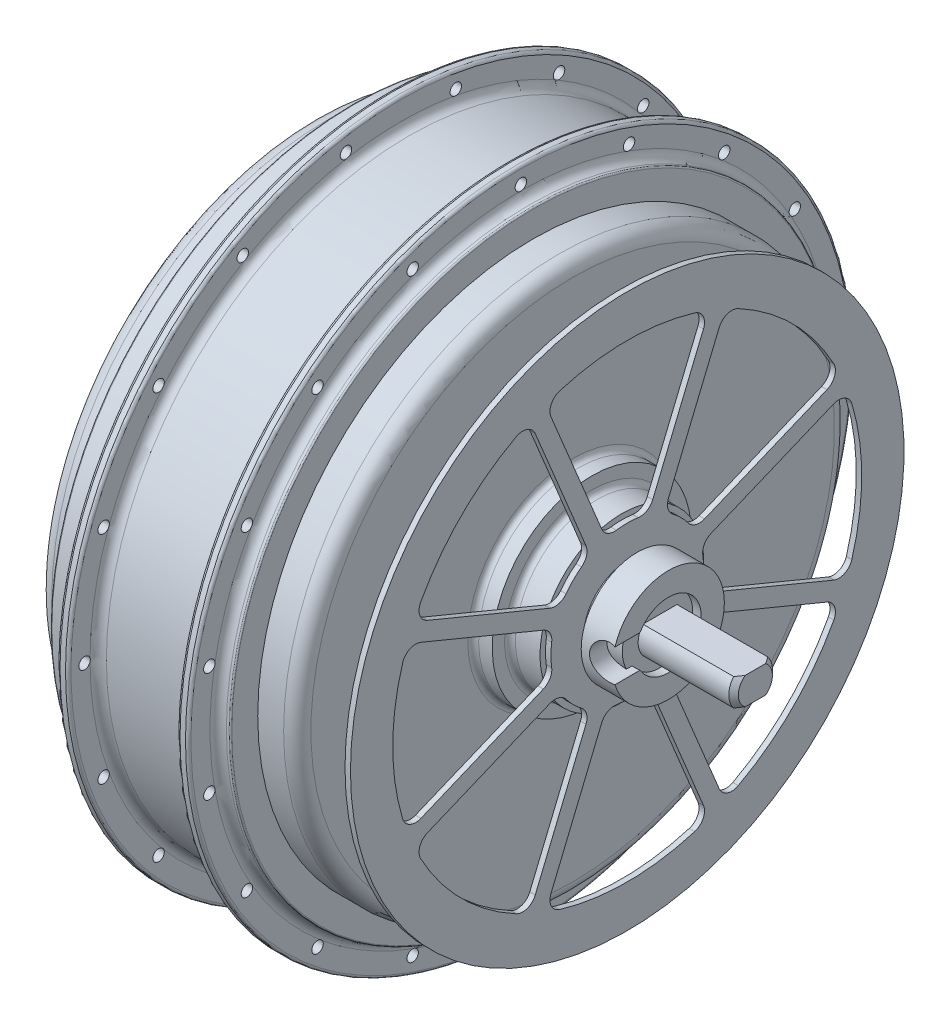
SolidWorks part; units mm, degrees
ref_plane "Front Plane" through (0, 0, 0) normal (0, 0, 1) x (1, 0, 0)
ref_plane "Top Plane" through (0, 0, 0) normal (0, 1, 0) x (1, 0, 0)
ref_plane "Right Plane" through (0, 0, 0) normal (1, 0, 0) x (0, 0, -1)
sketch "Sketch1" plane through (0, 0, 0) normal (0, 0, 1) x (1, 0, 0)
  line L0 (0, 0) -> (110, 0) construction
  line L1 (0, 0) -> (-110, 0) construction
  line L2 (0, 0) -> (0, 66.545) construction
  line L3 (-20, 111) -> (20, 111)
  line L4 (20, 111) -> (20, 122)
  line L5 (20, 122) -> (24, 122)
  line L6 (24, 122) -> (24, 111)
  line L7 (-20, 111) -> (-20, 122)
  line L8 (-20, 122) -> (-24, 122)
  line L9 (-24, 122) -> (-24, 111)
  line L10 (-24, 111) -> (-37.5, 111)
  line L11 (-37.5, 111) -> (-37.5, 101)
  line L12 (-37.5, 101) -> (-52, 101)
  line L13 (-52, 101) -> (-52, 26.5)
  line L14 (-52, 26.5) -> (-57.5, 26.5)
  line L15 (-57.5, 26.5) -> (-57.5, 17.45)
  line L16 (-57.5, 17.45) -> (-71.5, 17.45)
  line L17 (-71.5, 17.45) -> (-71.5, 0)
  line L18 (24, 111) -> (28.5, 111)
  line L19 (28.5, 111) -> (28.5, 101)
  line L20 (28.5, 101) -> (43, 101)
  line L21 (43, 101) -> (43, 36.5)
  line L22 (43, 36.5) -> (50, 36.5)
  line L23 (50, 36.5) -> (50, 30)
  line L24 (50, 30) -> (61, 30)
  line L25 (61, 30) -> (61, 0)
  line L26 (-71.5, 10) -> (-75, 10)
  line L27 (-75, 10) -> (-75, 0)
  line L28 (61, 14.4602) -> (75, 13.8)
  line L29 (75, 13.8) -> (75, 0)
  line L30 (61, 30) -> (61, 101.5)
  line L31 (61, 101.5) -> (63, 101.5)
  line L32 (63, 101.5) -> (63, 0)
  line L33 (-58, 17.45) -> (-58, 27.25)
  line L34 (-58, 27.25) -> (-74, 27.25)
  line L35 (-74, 27.25) -> (-74, 17.45)
  line L36 (-74, 17.45) -> (-71.5, 17.45)
  line L37 (-64.9, 27.25) -> (-64.9, 35.25)
  line L38 (-64.9, 35.25) -> (-67.1, 35.25)
  line L39 (-67.1, 35.25) -> (-67.1, 27.25)
  line L40 (-66, 35.25) -> (-66, 27.25) construction
  line L41 (-75, 8) -> (-110, 8)
  line L42 (-110, 8) -> (-110, 0)
  line L43 (75, 8) -> (110, 8)
  line L44 (110, 8) -> (110, 0)
  line L45 (-71.5, 10) -> (61, 10)
  line L46 (61, 16) -> (63, 16)
  line L47 (75, 12) -> (78.12, 12)
  line L48 (78.12, 12) -> (78.12, 20.5)
  line L49 (78.12, 20.5) -> (66.62, 20.5)
  line L50 (66.62, 20.5) -> (66.62, 14.1952)
  line L51 (-75, 10) -> (-75, 15)
  line L52 (-75, 15) -> (-77.88, 15)
  line L53 (-77.88, 15) -> (-77.88, 8)
  dimension "D1" = 244
  dimension "D2" = 222
  dimension "D3" = 4
  dimension "D4" = 34.9
  dimension "D5" = 13.5
  dimension "D6" = 4.5
  dimension "D7" = 14.5
  dimension "D8" = 14.5
  dimension "D9" = 202
  dimension "D10" = 48
  dimension "D11" = 95
  dimension "D12" = 53
  dimension "D13" = 20
  dimension "D14" = 75
  dimension "D15" = 71.5
  dimension "D16" = 57.5
  dimension "D17" = 75
  dimension "D18" = 14
  dimension "D19" = 60
  dimension "D20" = 73
  dimension "D21" = 18
  dimension "D22" = 7
  dimension "D23" = 27.6
  dimension "D24" = 2.7
  dimension "D25" = 150
  dimension "D26" = 2
  dimension "D27" = 203
  dimension "D28" = 54.5
  dimension "D29" = 0.5
  dimension "D30" = 16
  dimension "D31" = 2.2
  dimension "D32" = 9
  dimension "D33" = 8
  dimension "D34" = 12
  dimension "D35" = 51
  dimension "D36" = 16
  dimension "D37" = 35
  dimension "D38" = 35
  dimension "D39" = 16
  dimension "D40" = 24
  dimension "D41" = 11.5
  dimension "D42" = 3.12
  dimension "D43" = 41
  dimension "D44" = 30
  dimension "D45" = 2.88
  dimension "D46" = 156
sketch "Sketch2" plane through (0, 0, 0) normal (0, 0, 1) x (1, 0, 0)
  line L0 (-71.5, 17.45) -> (-71.5, 0) construction
  line L1 (-57.5, 17.45) -> (-71.5, 17.45) construction
  line L2 (-57.5, 26.5) -> (-57.5, 17.45) construction
  line L3 (-52, 26.5) -> (-57.5, 26.5) construction
  line L4 (-52, 101) -> (-52, 26.5) construction
  line L5 (-37.5, 101) -> (-52, 101) construction
  line L6 (-37.5, 111) -> (-37.5, 101) construction
  line L7 (-24, 111) -> (-37.5, 111) construction
  line L8 (-24, 122) -> (-24, 111) construction
  line L9 (-20, 122) -> (-24, 122) construction
  line L10 (-20, 111) -> (-20, 122) construction
  line L11 (-20, 111) -> (20, 111) construction
  line L12 (20, 111) -> (20, 122) construction
  line L13 (20, 122) -> (24, 122) construction
  line L14 (24, 122) -> (24, 111) construction
  line L15 (24, 111) -> (28.5, 111) construction
  line L16 (28.5, 111) -> (28.5, 101) construction
  line L17 (28.5, 101) -> (43, 101) construction
  line L18 (43, 101) -> (43, 36.5) construction
  line L19 (43, 36.5) -> (50, 36.5) construction
  line L20 (50, 36.5) -> (50, 30) construction
  line L21 (50, 30) -> (61, 30) construction
  line L22 (61, 30) -> (61, 0) construction
  line L23 (0, 0) -> (-110, 0) construction
  line L24 (-71.5, 17.45) -> (-71.5, 0)
  line L25 (-57.5, 17.45) -> (-71.5, 17.45)
  line L26 (-57.5, 26.5) -> (-57.5, 17.45)
  line L27 (-52, 26.5) -> (-57.5, 26.5)
  line L28 (-52, 101) -> (-52, 26.5)
  line L29 (-37.5, 101) -> (-52, 101)
  line L30 (-37.5, 111) -> (-37.5, 101)
  line L31 (-24, 111) -> (-37.5, 111)
  line L32 (-24, 122) -> (-24, 111)
  line L33 (-20, 122) -> (-24, 122)
  line L34 (-20, 111) -> (-20, 122)
  line L35 (-20, 111) -> (20, 111)
  line L36 (20, 111) -> (20, 122)
  line L37 (20, 122) -> (24, 122)
  line L38 (24, 122) -> (24, 111)
  line L39 (24, 111) -> (28.5, 111)
  line L40 (28.5, 111) -> (28.5, 101)
  line L41 (28.5, 101) -> (43, 101)
  line L42 (43, 101) -> (43, 36.5)
  line L43 (43, 36.5) -> (50, 36.5)
  line L44 (50, 36.5) -> (50, 30)
  line L45 (50, 30) -> (61, 30)
  line L46 (61, 30) -> (61, 0)
  line L47 (0, 0) -> (-71.5, 0)
  line L48 (0, 0) -> (110, 0) construction
  line L49 (0, 0) -> (61, 0)
revolve "Revolve1" add sketch "Sketch2" angle 360 about L1
fillet "Fillet1" radius 5 2 edges at (43, 101, 0) (-52, 101, 0)
fillet "Fillet2" radius 3 4 edges at (-24, 111, 0) (24, 111, 0) (20, 111, 0) (-20, 111, 0)
fillet "Fillet3" radius 1 4 edges at (-24, 122, 0) (20, 122, 0) (24, 122, 0) (-20, 122, 0)
fillet "Fillet4" radius 0.5 2 edges at (-37.5, 111, 0) (28.5, 111, 0)
fillet "Fillet5" radius 2 3 edges at (50, 30, 0) (43, 36.5, 0) (-52, 26.5, 0)
sketch "Sketch3" plane through (0, 0, 0) normal (0, 0, 1) x (1, 0, 0)
  line L0 (0, 0) -> (-110, 0) construction
  line L1 (-110, 8) -> (-110, 0) construction
  line L2 (-75, 8) -> (-110, 8) construction
  line L3 (-75, 10) -> (-75, 0) construction
  line L4 (-71.5, 10) -> (-75, 10) construction
  line L5 (-71.5, 10) -> (61, 10) construction
  line L6 (61, 30) -> (61, 0) construction
  line L7 (61, 14.4602) -> (75, 13.8) construction
  line L8 (75, 13.8) -> (75, 0) construction
  line L9 (75, 8) -> (110, 8) construction
  line L10 (110, 8) -> (110, 0) construction
  line L11 (0, 0) -> (110, 0) construction
  line L12 (0, 0) -> (-110, 0)
  line L13 (-110, 8) -> (-110, 0)
  line L14 (-75, 8) -> (-110, 8)
  line L15 (-75, 10) -> (-75, 8)
  line L16 (-71.5, 10) -> (-75, 10)
  line L17 (-71.5, 10) -> (61, 10)
  line L18 (61, 14.4602) -> (61, 10)
  line L19 (61, 14.4602) -> (75, 13.8)
  line L20 (75, 13.8) -> (75, 8)
  line L21 (75, 8) -> (110, 8)
  line L22 (110, 8) -> (110, 0)
  line L23 (0, 0) -> (110, 0)
revolve "Revolve2" add sketch "Sketch3" angle 360 about L23
sketch "Sketch4" plane through (0, 0, 0) normal (0, 0, 1) x (1, 0, 0)
  line L0 (0, 0) -> (110, 0) construction
  line L1 (63, 101.5) -> (63, 0) construction
  line L2 (61, 30) -> (61, 101.5) construction
  line L3 (61, 101.5) -> (63, 101.5) construction
  line L4 (61, 0) -> (63, 0) construction
  line L5 (63, 101.5) -> (63, 16)
  line L6 (61, 30) -> (61, 101.5)
  line L7 (61, 101.5) -> (63, 101.5)
  line L8 (61, 30) -> (61, 0) construction
  line L9 (61, 30) -> (61, 16)
  line L10 (61, 16) -> (63, 16) construction
  line L11 (61, 16) -> (63, 16)
revolve "Revolve3" add sketch "Sketch4" angle 360 about L4
sketch "Sketch5" plane through (63, 0, 0) normal (1, 0, 0) x (0, 0, -1)
  line L0 (0, 0) -> (0, 88.4744) construction
  line L1 (9.3506, 30.7457) -> (27.9519, 75.6533)
  line L2 (-9.3506, 30.7457) -> (-27.9519, 75.6533)
  arc A0 (24.7728, 82.3548) -> (-24.7728, 82.3548) centre (0, 0) ccw
  arc A1 (4.0143, 27.7107) -> (-4.0143, 27.7107) centre (0, 0) ccw
  arc A2 (9.3506, 30.7457) -> (4.0143, 27.7107) centre (4.7312, 32.6591) cw
  arc A3 (-9.3506, 30.7457) -> (-4.0143, 27.7107) centre (-4.7312, 32.6591) ccw
  arc A4 (27.9519, 75.6533) -> (24.7728, 82.3548) centre (23.3325, 77.5667) ccw
  arc A5 (-27.9519, 75.6533) -> (-24.7728, 82.3548) centre (-23.3325, 77.5667) cw
  point P13 (30, 80.5978)
  point P16 (-30, 80.5978)
  dimension "D2" = 28
  dimension "D3" = 86
  dimension "D5" = 5
  dimension "D1" = 45
  dimension "D4" = 60
extrude "Cut-Extrude1" cut sketch "Sketch5" against normal blind 10
pattern_circular "CirPattern1" count 8 over 360 about axis through (0, 0, 0) along (1, 0, 0) of "Cut-Extrude1"
sketch "Sketch6" plane through (0, 0, 0) normal (0, 0, 1) x (1, 0, 0)
  line L0 (-74, 17.45) -> (-71.5, 17.45) construction
  line L1 (-57.5, 17.45) -> (-71.5, 17.45) construction
  line L2 (-58, 17.45) -> (-58, 27.25) construction
  line L3 (-58, 27.25) -> (-74, 27.25) construction
  line L4 (-64.9, 27.25) -> (-64.9, 35.25) construction
  line L5 (-64.9, 35.25) -> (-67.1, 35.25) construction
  line L6 (-67.1, 35.25) -> (-67.1, 27.25) construction
  line L7 (-74, 27.25) -> (-74, 17.45) construction
  line L8 (-74, 17.45) -> (-71.5, 17.45)
  line L9 (-58, 17.45) -> (-71.5, 17.45)
  line L10 (-58, 17.45) -> (-58, 27.25)
  line L11 (-58, 27.25) -> (-64.9, 27.25)
  line L12 (-64.9, 27.25) -> (-64.9, 35.25)
  line L13 (-64.9, 35.25) -> (-67.1, 35.25)
  line L14 (-67.1, 35.25) -> (-67.1, 27.25)
  line L15 (-74, 27.25) -> (-74, 17.45)
  line L16 (-67.1, 27.25) -> (-74, 27.25)
revolve "Revolve4" add sketch "Sketch6" angle 360 about L1
sketch "Sketch7" plane through (-67.1, 0, 0) normal (-1, 0, 0) x (0, 0, 1)
  line L0 (0, 0) -> (0, 32) construction
  line L1 (-6.3509, 36) -> (-3.0311, 30.25)
  line L2 (3.0311, 30.25) -> (6.3509, 36)
  line L3 (6.3509, 36) -> (-6.3509, 36)
  arc A0 (-3.0311, 30.25) -> (3.0311, 30.25) centre (0, 32) ccw
  dimension "D1" = 3.5
  dimension "D2" = 32
  dimension "D3" = 60
  dimension "D4" = 4
extrude "Cut-Extrude2" cut sketch "Sketch7" against normal blind 10
pattern_circular "CirPattern2" count 16 over 360 about axis through (0, 0, 0) along (1, 0, 0) of "Cut-Extrude2"
sketch "Sketch8" plane through (0, 0, 0) normal (0, 0, 1) x (1, 0, 0)
  line L0 (75, 12) -> (78.12, 12) construction
  line L1 (75, 13.8) -> (75, 0) construction
  line L2 (61, 14.4602) -> (75, 13.8) construction
  line L3 (66.62, 20.5) -> (66.62, 14.1952) construction
  line L4 (78.12, 20.5) -> (66.62, 20.5) construction
  line L5 (78.12, 12) -> (78.12, 20.5) construction
  line L6 (75, 12) -> (78.12, 12)
  line L7 (75, 13.8) -> (75, 12)
  line L8 (66.62, 14.1952) -> (75, 13.8)
  line L9 (66.62, 20.5) -> (66.62, 14.1952)
  line L10 (78.12, 20.5) -> (66.62, 20.5)
  line L11 (78.12, 12) -> (78.12, 20.5)
revolve "Revolve5" add sketch "Sketch8" angle 360 about L0
sketch "Sketch9" plane through (0, 0, 0) normal (0, 0, 1) x (1, 0, 0)
  circle A0 centre (76, 0) radius 6.35
  dimension "D2" = 12.7
  dimension "D1" = 76
extrude "Cut-Extrude3" cut sketch "Sketch9" along normal blind 30
sketch "Sketch10" plane through (0, 0, 0) normal (0, 0, 1) x (1, 0, 0)
  line L0 (-75, 10) -> (-75, 15) construction
  line L1 (-75, 10) -> (-75, 0) construction
  line L2 (-75, 8) -> (-110, 8) construction
  line L3 (-77.88, 15) -> (-77.88, 8) construction
  line L4 (-75, 15) -> (-77.88, 15) construction
  line L5 (-75, 10) -> (-75, 15)
  line L6 (-75, 10) -> (-75, 8)
  line L7 (-75, 8) -> (-77.88, 8)
  line L8 (-77.88, 15) -> (-77.88, 8)
  line L9 (-75, 15) -> (-77.88, 15)
revolve "Revolve6" add sketch "Sketch10" angle 360 about L1
sketch "Sk-spoke_holes" plane through (0, 0, 0) normal (1, 0, 0) x (0, 0, -1)
  line L0 (0, 0) -> (0, 116) construction
  line L1 (0, 0) -> (20.1432, 114.2377) construction
  circle A0 centre (0, 116) radius 2.1
  circle A1 centre (20.1432, 114.2377) radius 2.1
  dimension "D2" = 4.2
  dimension "D1" = 116
  dimension "D3" = 10
sketch "Sketch12" plane through (0, 0, 0) normal (1, 0, 0) x (0, 0, -1)
  circle A0 centre (0, 116) radius 2.1 construction
  circle A1 centre (0, 116) radius 2.1
extrude "Cut-Extrude4" cut sketch "Sketch12" along normal blind 30
pattern_circular "CirPattern3" count 18 over 360 about axis through (0, 0, 0) along (1, 0, 0) of "Cut-Extrude4"
sketch "Sketch13" plane through (0, 0, 0) normal (1, 0, 0) x (0, 0, -1)
  circle A0 centre (20.1432, 114.2377) radius 2.1 construction
  circle A1 centre (20.1432, 114.2377) radius 2.1
extrude "Cut-Extrude5" cut sketch "Sketch13" against normal blind 30
pattern_circular "CirPattern4" count 18 over 360 about axis through (0, 0, 0) along (1, 0, 0) of "Cut-Extrude5"
sketch "Sketch14" plane through (0, 0, 0) normal (0, 0, 1) x (1, 0, 0)
  line L0 (0, 0) -> (140.1574, 0) construction
  line L1 (-75, 20) -> (-75, 5)
  line L2 (-75, 5) -> (-125, 5)
  line L3 (-125, 5) -> (-125, 20)
  line L4 (-125, 20) -> (-75, 20)
  line L5 (-75, -5) -> (-125, -5)
  line L6 (-125, -5) -> (-125, -20)
  line L7 (-125, -20) -> (-75, -20)
  line L8 (-75, -20) -> (-75, -5)
  line L9 (75, 20) -> (75, 5)
  line L10 (75, 5) -> (125, 5)
  line L11 (125, 5) -> (125, 20)
  line L12 (125, 20) -> (75, 20)
  line L13 (75, -5) -> (125, -5)
  line L14 (125, -5) -> (125, -20)
  line L15 (125, -20) -> (75, -20)
  line L16 (75, -20) -> (75, -5)
  dimension "D1" = 50
  dimension "D2" = 15
  dimension "D3" = 10
  dimension "D4" = 75
  dimension "D5" = 75
extrude "Cut-Extrude6" cut sketch "Sketch14" against normal mid plane 30
chamfer "Chamfer1" distance 1.75 angle 45 4 edges at (110, 0, 8) (110, 0, -8) (-110, 0, -8) (-110, 0, 8)
ref_plane "Plane1" through (-66, 0, 0) normal (1, 0, 0) x (0, 0, -1)
sketch "Sketch15" plane through (-66, 0, 0) normal (1, 0, 0) x (0, 0, -1)
  circle A0 centre (0, 0) radius 32.5
  dimension "D1" = 65
